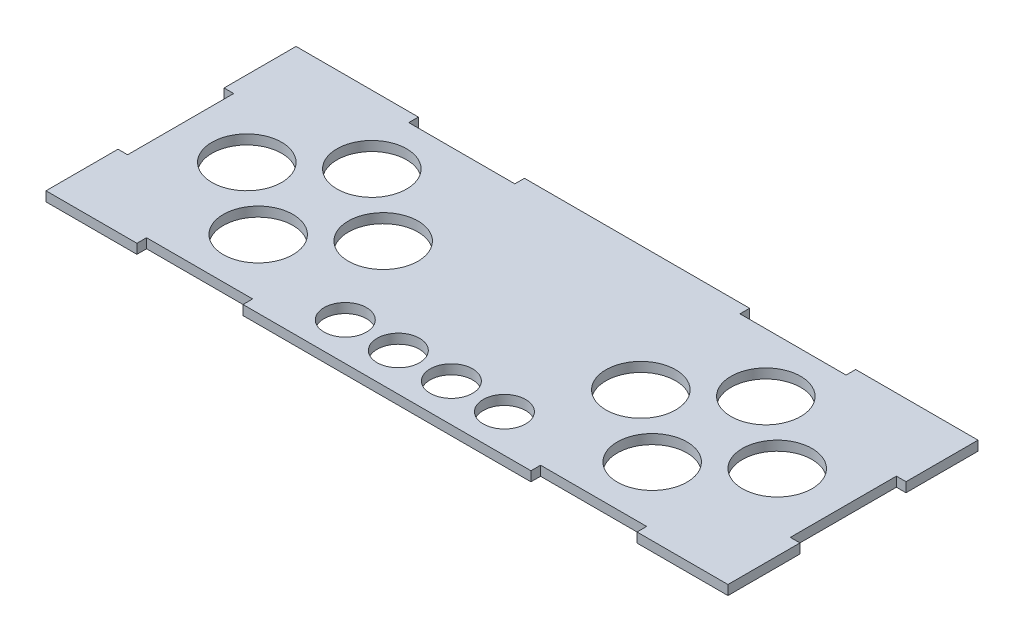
SolidWorks part; units mm, degrees
ref_plane "Front Plane" through (0, 0, 0) normal (0, 0, 1) x (1, 0, 0)
ref_plane "Top Plane" through (0, 0, 0) normal (0, 1, 0) x (1, 0, 0)
ref_plane "Right Plane" through (0, 0, 0) normal (1, 0, 0) x (0, 0, -1)
sketch "Sketch1" plane through (0, 0, 0) normal (0, 1, 0) x (1, 0, 0)
  line L0 (74.275, 82.5) -> (-74.275, 82.5)
  line L1 (225, -82.5) -> (165, -82.5)
  line L2 (225, -82.5) -> (225, -35)
  line L3 (225, 82.5) -> (144.275, 82.5)
  line L4 (-225, -82.5) -> (-225, -35)
  line L5 (225, -82.5) -> (-225, 82.5) construction
  line L6 (225, 82.5) -> (-225, -82.5) construction
  line L8 (-165, -82.5) -> (-165, -76.15)
  line L9 (-165, -76.15) -> (-95, -76.15)
  line L10 (-95, -82.5) -> (-95, -76.15)
  line L12 (95, -82.5) -> (95, -76.15)
  line L13 (95, -76.15) -> (165, -76.15)
  line L14 (165, -82.5) -> (165, -76.15)
  line L15 (-225, -35) -> (-218.65, -35)
  line L17 (-225, 35) -> (-218.65, 35)
  line L18 (-218.65, -35) -> (-218.65, 35)
  line L19 (225, -35) -> (218.65, -35)
  line L21 (225, 35) -> (218.65, 35)
  line L22 (218.65, -35) -> (218.65, 35)
  line L24 (-144.275, 82.5) -> (-144.275, 76.15)
  line L25 (-144.275, 76.15) -> (-74.275, 76.15)
  line L26 (-74.275, 82.5) -> (-74.275, 76.15)
  line L28 (74.275, 82.5) -> (74.275, 76.15)
  line L29 (74.275, 76.15) -> (144.275, 76.15)
  line L30 (144.275, 82.5) -> (144.275, 76.15)
  line L31 (225, 35) -> (225, 82.5)
  line L32 (95, -82.5) -> (-95, -82.5)
  line L33 (-165, -82.5) -> (-225, -82.5)
  line L34 (-225, 35) -> (-225, 82.5)
  line L35 (-144.275, 82.5) -> (-225, 82.5)
  circle A0 centre (-130, 37.5) radius 23
  circle A1 centre (-85, 0) radius 23
  circle A2 centre (-175, 0) radius 23
  circle A3 centre (-130, -37.5) radius 23
  circle A4 centre (130, 37.5) radius 23
  circle A5 centre (85, 0) radius 23
  circle A6 centre (175, 0) radius 23
  circle A7 centre (130, -37.5) radius 23
  circle A8 centre (-52.5, -57.5) radius 14
  circle A9 centre (-17.5, -57.5) radius 14
  circle A10 centre (17.5, -57.5) radius 14
  circle A11 centre (52.5, -57.5) radius 14
  point P0 (0, 0)
  point P39 (-130, -76.15)
  dimension "D3" = 46
  dimension "D4" = 46
  dimension "D5" = 46
  dimension "D6" = 46
  dimension "D7" = 50
  dimension "D8" = 82.5
  dimension "D9" = 45
  dimension "D10" = 95
  dimension "D11" = 95
  dimension "D12" = 45
  dimension "D13" = 82.5
  dimension "D14" = 140
  dimension "D15" = 45
  dimension "D16" = 45
  dimension "D17" = 50
  dimension "D18" = 140
  dimension "D19" = 95
  dimension "D20" = 95
  dimension "D21" = 46
  dimension "D22" = 46
  dimension "D23" = 46
  dimension "D24" = 46
  dimension "D25" = 82.5
  dimension "D26" = 82.5
  dimension "D27" = 28
  dimension "D28" = 28
  dimension "D29" = 28
  dimension "D30" = 28
  dimension "D31" = 25
  dimension "D32" = 35
  dimension "D33" = 35
  dimension "D34" = 35
  dimension "D35" = 25
  dimension "D36" = 25
  dimension "D37" = 25
  dimension "D38" = 172.5
  dimension "D1" = 450
  dimension "D2" = 165
  dimension "D39" = 70
  dimension "D40" = 70
  dimension "D41" = 6.35
  dimension "D42" = 6.35
  dimension "D43" = 60
  dimension "D44" = 70
  dimension "D45" = 6.35
  dimension "D46" = 47.5
  dimension "D47" = 70
  dimension "D48" = 6.35
  dimension "D49" = 47.5
  dimension "D50" = 60
  dimension "D51" = 6.35
  dimension "D52" = 70
  dimension "D53" = 80.725
  dimension "D54" = 70
  dimension "D55" = 6.35
  dimension "D56" = 80.725
extrude "Boss-Extrude1" add sketch "Sketch1" along normal blind 6.35
